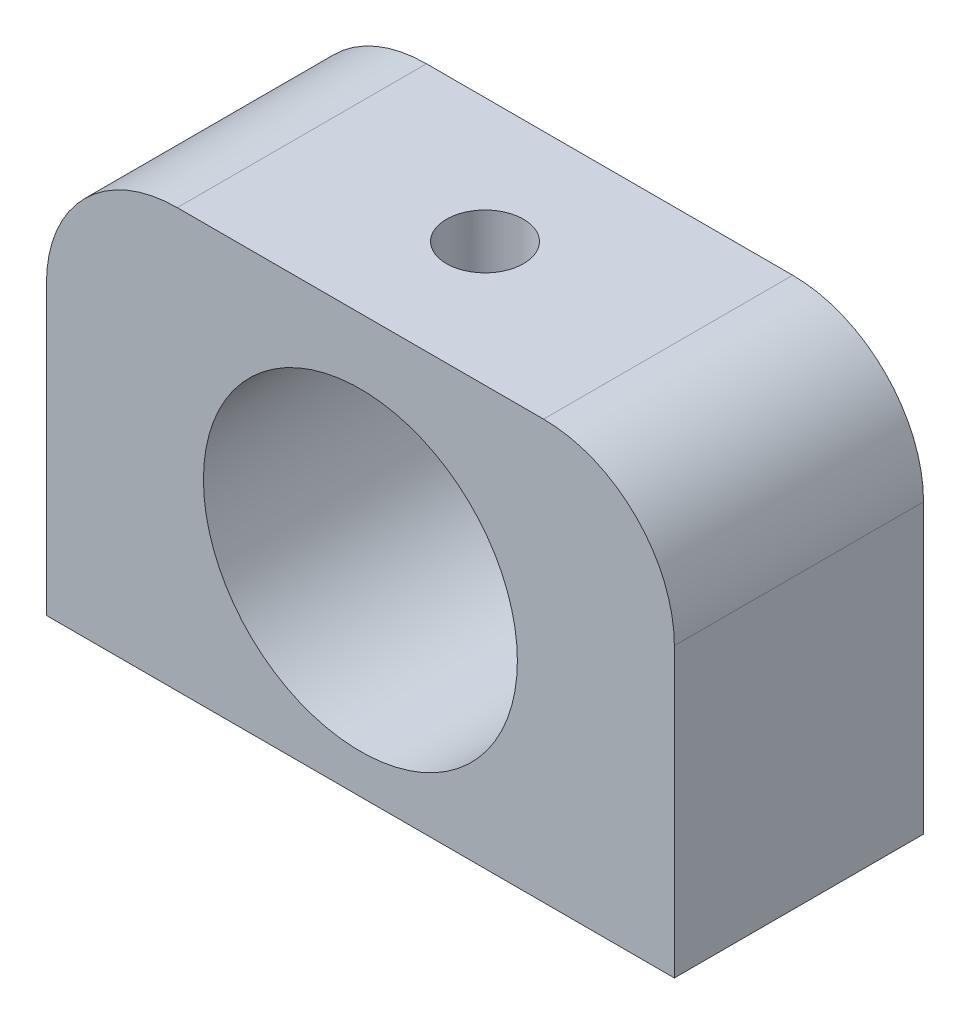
SolidWorks part; units mm, degrees
ref_plane "Front Plane" through (0, 0, 0) normal (0, 0, 1) x (1, 0, 0)
ref_plane "Top Plane" through (0, 0, 0) normal (0, 1, 0) x (1, 0, 0)
ref_plane "Right Plane" through (0, 0, 0) normal (1, 0, 0) x (0, 0, -1)
sketch "Sketch1" plane through (0, 0, 0) normal (0, 0, 1) x (1, 0, 0)
  line L1 (0, 0) -> (24, 0)
  line L2 (0, 0) -> (0, 16)
  line L3 (0, 16) -> (24, 16)
  line L4 (24, 0) -> (24, 16)
  dimension "D1" = 24
  dimension "D2" = 16
extrude "Boss-Extrude1" add sketch "Sketch1" along normal blind 9.525
sketch "Sketch2" plane through (0, 0, 0) normal (0, -1, 0) x (1, 0, 0)
  line L0 (0, 9.525) -> (0, 0) construction
  line L1 (24, 9.525) -> (24, 0) construction
  line L2 (0, 9.525) -> (24, 9.525) construction
  circle A0 centre (3, 4.7625) radius 1.5
  circle A1 centre (21, 4.7625) radius 1.5
  dimension "D3" = 3
  dimension "D1" = 3
  dimension "D2" = 3
  dimension "D4" = 4.7625
hole_wizard "#4 Clearance Hole1" positions "Sketch6" profile "Sketch5" hole size "#4" standard "ANSI Inch"
sketch "Sketch6" plane through (0, 0, 0) normal (0, -1, 0) x (-1, 0, 0)
  point P0 (-3, -4.7625)
  point P3 (-21, -4.7625)
sketch "Sketch5" plane through (3, 0, 4.7625) normal (1, 0, 0) x (0, 0, -1)
  line L0 (0, 0) -> (0, 13.6806)
  line L1 (0, 13.6806) -> (1.6319, 12.7)
  line L2 (1.6319, 12.7) -> (1.6319, 0)
  line L5 (1.6319, 0) -> (0, 0)
  line L10 (0, 13.6806) -> (-1.632, 12.7) construction
  line L11 (0, -6.35) -> (0, 107.95) construction
  dimension "Hole Dia." = 3.2639
  dimension "Hole Depth" = 12.7
  dimension "Drill Angle" = 118
sketch "Sketch8" plane through (0, 0, 9.525) normal (0, 0, 1) x (1, 0, 0)
  line L0 (24, 0) -> (24, 16) construction
  line L1 (0, 0) -> (24, 0) construction
  circle A0 centre (12, 7.5) radius 6
  dimension "D2" = 12
  dimension "D1" = 12
  dimension "D3" = 7.5
extrude "Cut-Extrude1" cut sketch "Sketch8" against normal through all
sketch "Sketch9" plane through (0, 16, 0) normal (0, 1, 0) x (1, 0, 0)
  line L0 (24, 0) -> (0, 0) construction
  line L1 (0, -9.525) -> (0, 0) construction
  circle A0 centre (12, -4.7625) radius 1.7381
  dimension "D1" = 4.7625
  dimension "D2" = 12
hole_wizard "#4 Clearance Hole2" positions "Sketch11" profile "Sketch10" hole size "#4" standard "ANSI Inch"
sketch "Sketch11" plane through (0, 16, 0) normal (0, 1, 0) x (1, 0, 0)
  point P0 (12, -4.7625)
sketch "Sketch10" plane through (12, 16, 4.7625) normal (1, 0, 0) x (0, 0, 1)
  line L0 (0, 0) -> (0, 5.8852)
  line L1 (0, 5.8852) -> (1.4732, 5)
  line L2 (1.4732, 5) -> (1.4732, 0)
  line L5 (1.4732, 0) -> (0, 0)
  line L10 (0, 5.8852) -> (-1.4732, 5) construction
  line L11 (0, -6.35) -> (0, 107.95) construction
  dimension "Hole Dia." = 2.9464
  dimension "Hole Depth" = 5
  dimension "Drill Angle" = 118
fillet "Fillet2" radius 5 2 edges at (24, 16, 4.7625) (0, 16, 4.7625)
